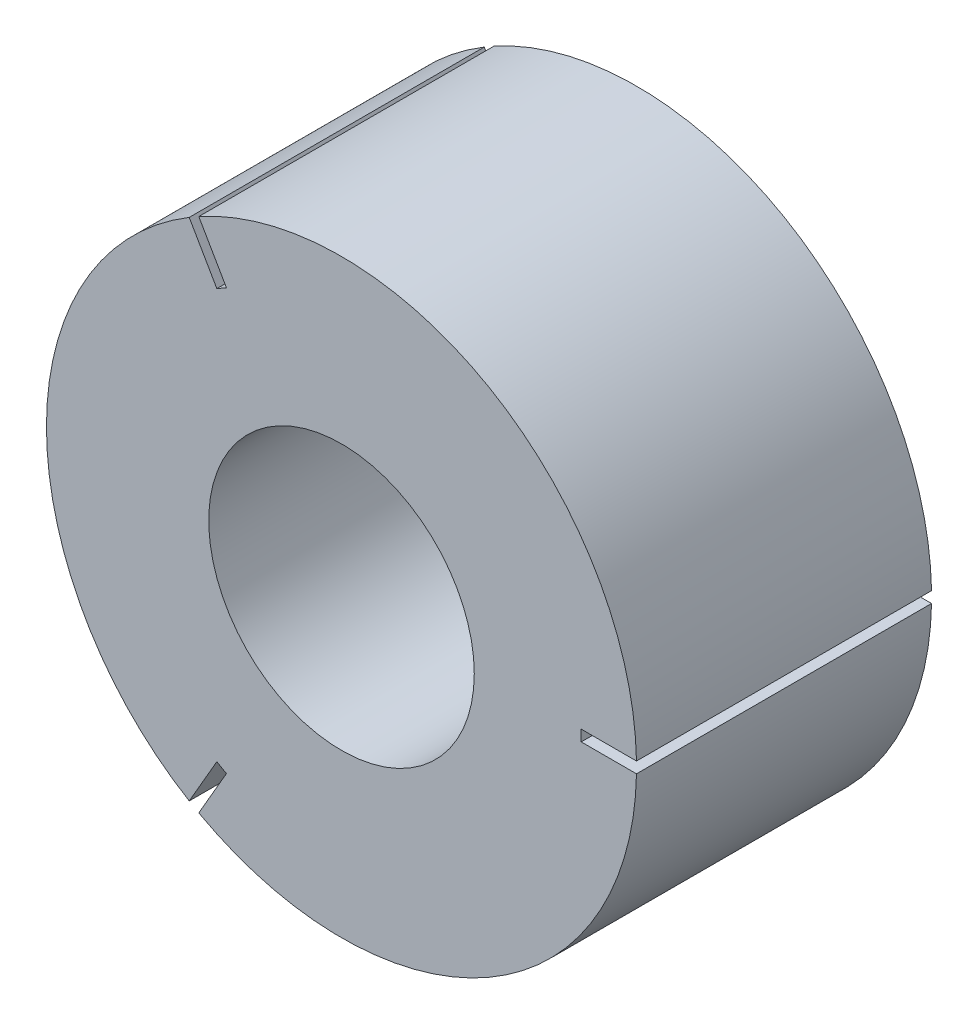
SolidWorks part; units mm, degrees
ref_plane "Front" through (0, 0, 0) normal (0, 0, 1) x (1, 0, 0)
ref_plane "Top" through (0, 0, 0) normal (0, 1, 0) x (1, 0, 0)
ref_plane "Right" through (0, 0, 0) normal (1, 0, 0) x (0, 0, -1)
sketch "Sketch1" plane through (0, 0, 0) normal (0, 0, 1) x (1, 0, 0)
  circle A0 centre (0, 0) radius 40
  dimension "D1" = 80
extrude "Extrude1" add sketch "Sketch1" along normal blind 40
sketch "Sketch2" plane through (0, 0, 40) normal (0, 0, 1) x (1, 0, 0)
  circle A0 centre (0, 0) radius 18
  dimension "D1" = 36
extrude "Cut-Extrude1" cut sketch "Sketch2" against normal through all
sketch "Sketch3" plane through (0, 0, 40) normal (0, 0, 1) x (1, 0, 0)
  line L0 (0, 0) -> (51.6261, 0) construction
  line L2 (40, 0.75) -> (32.5, 0.75)
  line L3 (40, 0.75) -> (40, -0.75)
  line L4 (40, -0.75) -> (32.5, -0.75)
  line L5 (32.5, 0.75) -> (32.5, -0.75)
  circle A0 centre (0, 0) radius 32.5 construction
  circle A1 centre (0, 0) radius 40 construction
  dimension "D1" = 65
  dimension "D2" = 1.5
  dimension "D3" = 0.75
extrude "Cut-Extrude2" cut sketch "Sketch3" against normal through all
pattern_circular "CirPattern1" count 3 over 360 about axis through (0, 0, 0) along (0, 0, 1) of "Cut-Extrude2"
equation "\"D3@Sketch3\" = \"D2@Sketch3\"/2"
